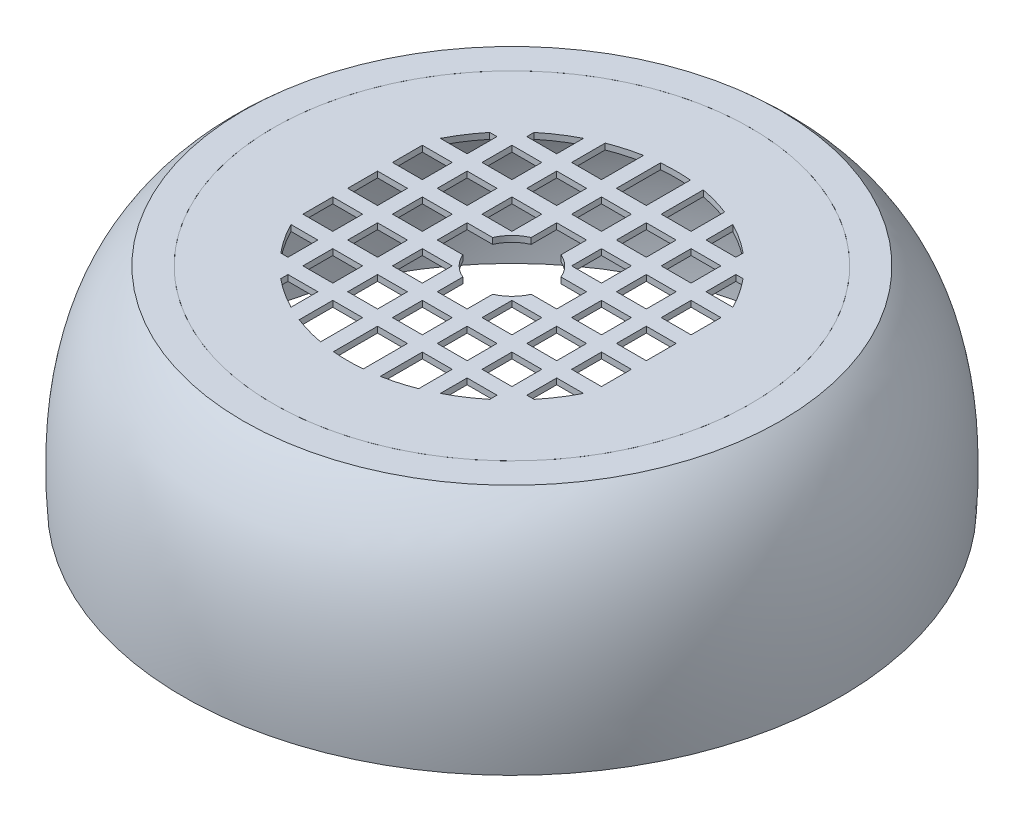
SolidWorks part; units mm, degrees
ref_plane "Alzado" through (0, 0, 0) normal (0, 0, 1) x (1, 0, 0)
ref_plane "Planta" through (0, 0, 0) normal (0, 1, 0) x (1, 0, 0)
ref_plane "Vista lateral" through (0, 0, 0) normal (1, 0, 0) x (0, 0, -1)
sketch "Croquis2" plane through (0, 0, 0) normal (0, 0, 1) x (1, 0, 0)
  line L0 (-90, 70) -> (-80, 70)
  line L1 (-110, 0) -> (-100, 0)
  line L2 (0, 0) -> (0, 101.7099) construction
  spline S0 degree 2 poles (-110, 0) (-113.3713, 49.7982) (-90, 70) knots 0 0 0 0.517639 0.517639 0.517639
  spline S1 degree 2 poles (-100, 0) (-102.8261, 46.4518) (-80, 70) knots 0 0 0 0.542382 0.542382 0.542382
  dimension "D1" = 100
  dimension "D2" = 110
  dimension "D3" = 90
  dimension "D4" = 80
revolve "Revolución1" add sketch "Croquis2" angle 360 about L2
sketch "Croquis3" plane through (0, 70, 0) normal (0, 1, 0) x (1, 0, 0)
  circle A0 centre (0, 0) radius 80
  dimension "D1" = 160
extrude "Saliente-Extruir1" add sketch "Croquis3" against normal blind 2 separate body
sketch "Croquis4" plane through (0, 70, 0) normal (0, 1, 0) x (1, 0, 0)
  circle A0 centre (0, 0) radius 12.5
  dimension "D1" = 25
extrude "Cortar-Extruir1" cut sketch "Croquis4" against normal up to next (2 mm away)
sketch "Croquis5" plane through (0, 70, 0) normal (0, 1, 0) x (1, 0, 0)
  line L0 (-20, -40) -> (-20, -51.2348)
  line L1 (-10, -40) -> (-10, -54.0833)
  line L2 (-40, 35) -> (-40, 25)
  line L3 (-25, 48.9898) -> (-25, 40)
  line L4 (-10, 54.0833) -> (-10, 40)
  line L5 (-25, -40) -> (-35, -40)
  line L6 (-25, -35) -> (-35, -35)
  line L7 (5, 54.7723) -> (5, 40)
  line L8 (20, 51.2348) -> (20, 40)
  line L9 (-10, -40) -> (-20, -40)
  line L10 (-10, -35) -> (-20, -35)
  line L11 (-10, -25) -> (-20, -25)
  line L12 (-10, -25) -> (-10, -35)
  line L13 (-20, -25) -> (-20, -35)
  line L14 (-25, -25) -> (-35, -25)
  line L15 (-25, -20) -> (-35, -20)
  line L16 (50, -10) -> (40, -10)
  line L17 (-35, 42.4264) -> (-35, 40)
  line L18 (50, 5) -> (40, 5)
  line L19 (-20, 51.2348) -> (-20, 40)
  line L20 (50, 20) -> (40, 20)
  line L21 (-5, 55) -> (-5, 40)
  line L22 (-10, -20) -> (-20, -20)
  line L23 (10, 54.0833) -> (10, 40)
  line L24 (-10, -10) -> (-20, -10)
  line L25 (-55, 115) -> (-55, 5)
  line L26 (-55, 130) -> (-55, 20)
  line L27 (-55, 145) -> (-55, 35)
  line L28 (-55, 160) -> (-55, 50)
  line L29 (-55, 100) -> (-55, -10)
  line L30 (-55, 85) -> (-55, -25)
  line L31 (-55, 70) -> (-55, -40)
  line L32 (-25, -10) -> (-35, -10)
  line L33 (-20, -10) -> (-20, -20)
  line L34 (-10, -10) -> (-10, -20)
  line L35 (-25, -5) -> (-35, -5)
  line L36 (50, -20) -> (40, -20)
  line L37 (50, -5) -> (40, -5)
  line L38 (50, 10) -> (40, 10)
  line L39 (-11.3984, -5) -> (-20, -5)
  line L40 (-11.3984, 5) -> (-20, 5)
  line L41 (-25, 5) -> (-35, 5)
  line L42 (-20, 5) -> (-20, -5)
  line L43 (10, -40) -> (10, -54.0833)
  line L44 (-50, 20) -> (-50, 10)
  line L45 (-25, 10) -> (-35, 10)
  line L46 (-10, 10) -> (-20, 10)
  line L47 (-10, 20) -> (-20, 20)
  line L48 (-10, 20) -> (-10, 10)
  line L49 (-20, 20) -> (-20, 10)
  line L50 (-25, 20) -> (-35, 20)
  line L51 (-25, 25) -> (-35, 25)
  line L52 (-10, 25) -> (-20, 25)
  line L53 (-25, 35) -> (-35, 35)
  line L54 (-20, 35) -> (-20, 25)
  line L55 (-10, 35) -> (-10, 25)
  line L56 (20, -25) -> (10, -25)
  line L57 (-10, 35) -> (-20, 35)
  line L58 (35, -40) -> (25, -40)
  line L59 (-10, 40) -> (-20, 40)
  line L60 (42.4264, -35) -> (40, -35)
  line L61 (48.9898, -25) -> (40, -25)
  line L62 (-25, 40) -> (-35, 40)
  line L63 (50, 20) -> (50, 10)
  line L64 (48.9898, 25) -> (40, 25)
  line L65 (42.4264, 35) -> (40, 35)
  line L66 (40, 35) -> (40, 25)
  line L67 (35, 40) -> (25, 40)
  line L68 (35, 42.4264) -> (35, 40)
  line L69 (25, 48.9898) -> (25, 40)
  line L70 (35, -40) -> (35, -42.4264)
  line L71 (-55, 40) -> (-55, -55)
  line L72 (-55, 40) -> (-55, -55)
  line L73 (-55, 40) -> (-55, -55)
  line L74 (55, -55) -> (-55, -55)
  line L75 (-50, 40) -> (-50, 25)
  line L76 (55, 50) -> (25, 50)
  line L77 (35, 55) -> (35, 50)
  line L78 (50, 55) -> (50, 25)
  line L79 (55, -40) -> (40, -40)
  line L80 (55, -25) -> (50, -25)
  line L81 (55, 35) -> (50, 35)
  line L82 (5, -40) -> (-5, -40)
  line L83 (5, -40) -> (5, -54.7723)
  line L84 (-5, -40) -> (-5, -54.7723)
  line L85 (5, -35) -> (-5, -35)
  line L86 (5, -25) -> (-5, -25)
  line L87 (5, -25) -> (5, -35)
  line L88 (-5, -25) -> (-5, -35)
  line L89 (5, -20) -> (-5, -20)
  line L91 (5, -11.3984) -> (5, -20)
  line L92 (-5, -11.3984) -> (-5, -20)
  line L98 (5, 20) -> (-5, 20)
  line L99 (5, 20) -> (5, 11.3984)
  line L100 (-5, 20) -> (-5, 11.3984)
  line L101 (5, 25) -> (-5, 25)
  line L102 (5, 35) -> (-5, 35)
  line L103 (5, 35) -> (5, 25)
  line L104 (-5, 35) -> (-5, 25)
  line L105 (5, 40) -> (-5, 40)
  line L106 (20, -40) -> (20, -51.2348)
  line L107 (25, -40) -> (25, -48.9898)
  line L108 (20, -40) -> (10, -40)
  line L109 (20, -35) -> (10, -35)
  line L110 (20, -25) -> (20, -35)
  line L111 (10, -25) -> (10, -35)
  line L112 (20, -20) -> (10, -20)
  line L113 (20, -10) -> (10, -10)
  line L114 (20, -10) -> (20, -20)
  line L115 (10, -10) -> (10, -20)
  line L116 (20, -5) -> (11.3984, -5)
  line L117 (20, 5) -> (11.3984, 5)
  line L118 (20, 5) -> (20, -5)
  line L120 (20, 20) -> (20, 10)
  line L121 (10, 20) -> (10, 10)
  line L122 (20, 20) -> (10, 20)
  line L123 (20, 10) -> (10, 10)
  line L124 (20, 25) -> (10, 25)
  line L125 (20, 35) -> (10, 35)
  line L126 (20, 40) -> (10, 40)
  line L127 (20, 35) -> (20, 25)
  line L128 (10, 35) -> (10, 25)
  line L129 (35, -35) -> (25, -35)
  line L130 (35, -25) -> (25, -25)
  line L131 (35, -25) -> (35, -35)
  line L132 (25, -25) -> (25, -35)
  line L133 (35, -20) -> (25, -20)
  line L134 (35, -10) -> (25, -10)
  line L135 (35, -10) -> (35, -20)
  line L136 (25, -10) -> (25, -20)
  line L137 (35, -5) -> (25, -5)
  line L138 (35, 5) -> (25, 5)
  line L139 (35, 5) -> (35, -5)
  line L140 (25, 5) -> (25, -5)
  line L141 (35, 10) -> (25, 10)
  line L142 (35, 20) -> (25, 20)
  line L143 (35, 20) -> (35, 10)
  line L144 (25, 20) -> (25, 10)
  line L145 (35, 25) -> (25, 25)
  line L146 (35, 35) -> (25, 35)
  line L147 (35, 35) -> (35, 25)
  line L148 (25, 35) -> (25, 25)
  line L149 (40, -25) -> (40, -35)
  line L150 (40, -10) -> (40, -20)
  line L151 (50, -10) -> (50, -20)
  line L152 (50, 5) -> (50, -5)
  line L153 (40, 5) -> (40, -5)
  line L154 (40, 20) -> (40, 10)
  line L155 (-35, -40) -> (-35, -42.4264)
  line L156 (-25, -40) -> (-25, -48.9898)
  line L157 (-40, -35) -> (-42.4264, -35)
  line L158 (-40, -25) -> (-48.9898, -25)
  line L159 (-40, -20) -> (-50, -20)
  line L160 (-35, -25) -> (-35, -35)
  line L161 (-25, -25) -> (-25, -35)
  line L162 (-40, -10) -> (-50, -10)
  line L163 (-40, -5) -> (-50, -5)
  line L164 (-35, -10) -> (-35, -20)
  line L165 (-25, -10) -> (-25, -20)
  line L166 (-40, 5) -> (-50, 5)
  line L167 (-40, 10) -> (-50, 10)
  line L168 (-40, 20) -> (-50, 20)
  line L169 (-40, 25) -> (-48.9898, 25)
  line L170 (-35, 5) -> (-35, -5)
  line L171 (-25, 5) -> (-25, -5)
  line L172 (-35, 20) -> (-35, 10)
  line L173 (-25, 20) -> (-25, 10)
  line L174 (-40, 35) -> (-42.4264, 35)
  line L175 (-35, 35) -> (-35, 25)
  line L176 (-25, 35) -> (-25, 25)
  line L177 (-40, -25) -> (-40, -35)
  line L178 (-40, -10) -> (-40, -20)
  line L179 (-50, -10) -> (-50, -20)
  line L180 (-40, 20) -> (-40, 10)
  line L181 (-40, 5) -> (-40, -5)
  line L182 (-50, 5) -> (-50, -5)
  arc A0 (-35, -42.4264) -> (-25, -48.9898) centre (0, 0) ccw
  arc A1 (-5, -11.3984) -> (5, -11.3984) centre (0, 0) ccw
  arc A2 (-48.9898, -25) -> (-42.4264, -35) centre (0, 0) ccw
  arc A3 (11.3984, -5) -> (11.3984, 5) centre (0, 0) ccw
  arc A4 (5, 11.3984) -> (-5, 11.3984) centre (0, 0) ccw
  arc A5 (-11.3984, 5) -> (-11.3984, -5) centre (0, 0) ccw
  arc A6 (-42.4264, 35) -> (-48.9898, 25) centre (0, 0) ccw
  arc A8 (-25, 48.9898) -> (-35, 42.4264) centre (0, 0) ccw
  arc A9 (-10, 54.0833) -> (-20, 51.2348) centre (0, 0) ccw
  arc A10 (5, 54.7723) -> (-5, 54.7723) centre (0, 0) ccw
  arc A11 (20, 51.2348) -> (10, 54.0833) centre (0, 0) ccw
  arc A12 (35, 42.4264) -> (25, 48.9898) centre (0, 0) ccw
  arc A14 (48.9898, 25) -> (42.4264, 35) centre (0, 0) ccw
  arc A19 (42.4264, -35) -> (48.9898, -25) centre (0, 0) ccw
  arc A20 (25, -48.9898) -> (35, -42.4264) centre (0, 0) ccw
  arc A21 (10, -54.0833) -> (20, -51.2348) centre (0, 0) ccw
  arc A22 (-5, -54.7723) -> (5, -54.7723) centre (0, 0) ccw
  arc A23 (-20, -51.2348) -> (-10, -54.0833) centre (0, 0) ccw
  dimension "D3" = 2
  dimension "D1" = 8
  dimension "D2" = 8
  dimension "D4" = 2
  dimension "D6" = 2
  dimension "D7" = 2
extrude "Cortar-Extruir2" cut sketch "Croquis5" against normal up to next (2 mm away) contours L176 L53 L175 L51 | L2 L174 L169 M28 | L180 L168 L44 L167 | L173 L50 L172 L45 | L166 L182 L163 L181 | L171 L41 L170 L35 | L162 L179 L159 L178 | L165 L32 L164 L15 | L177 L158 L157 M28 | L161 L14 L160 L6 | L34 L24 L33 L22 | L40 L42 L39 M27 | L47 L49 L46 L48 | L55 L57 L54 L52 | L59 L4 L19 M28 | L62 L3 L17 M28 | L156 L5 L155 M28 | L1 L9 L0 M28 | L11 L13 L10 L12 | L82 L84 L83 M28 | L86 L88 L85 L87 | L92 L89 L91 M27 | L98 L100 L99 M27 | L102 L104 L101 L103 | L105 L7 L21 M28 | L106 L108 L43 M28 | L56 L111 L109 L110 | L113 L115 L112 L114 | L118 L117 L116 M27 | L123 L120 L122 L121 | L125 L128 L124 L127 | L126 L8 L23 M28 | L58 L107 L70 M28 | L130 L132 L129 L131 | L134 L136 L133 L135 | L142 L144 L141 L143 | L146 L148 L145 L147 | L69 L67 L68 M28 | L61 L149 L60 M28 | L151 L16 L150 L36 | L18 L153 L37 L152 | L20 L154 L38 L63 | L65 L66 L64 M28 | L139 L137 L140 L138
